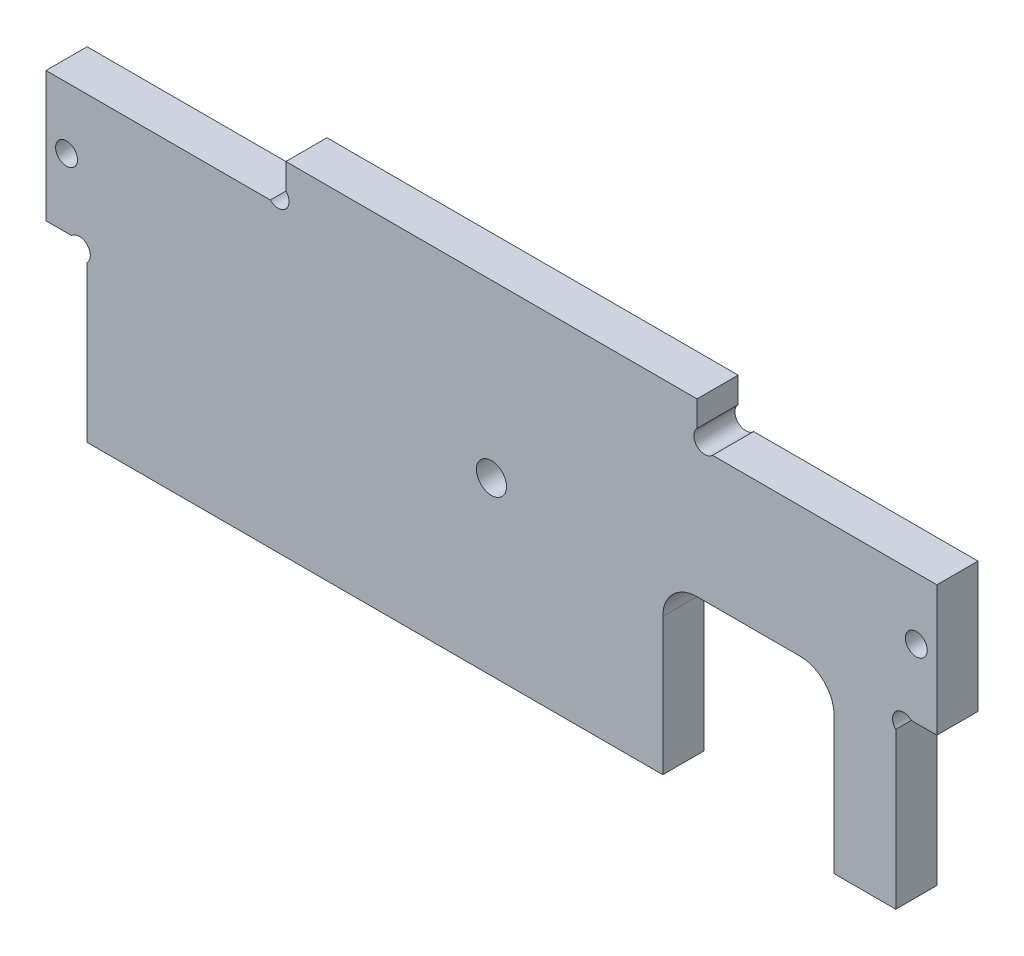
SolidWorks part; units mm, degrees
ref_plane "Plan de face" through (0, 0, 0) normal (0, 0, 1) x (1, 0, 0)
ref_plane "Plan de dessus" through (0, 0, 0) normal (0, 1, 0) x (1, 0, 0)
ref_plane "Plan de droite" through (0, 0, 0) normal (1, 0, 0) x (0, 0, -1)
sketch "Esquisse1" plane through (0, 0, 0) normal (0, 0, 1) x (1, 0, 0)
  line L0 (0, -5.3425) -> (0, 69.7724) construction
  line L1 (-53.7752, 0) -> (81.3864, 0) construction
  line L2 (-53.7752, 50) -> (81.3864, 50) construction
  line L3 (65, -11.6335) -> (65, 77.9943) construction
  line L4 (-65, -5.3425) -> (-65, 79.3023) construction
  line L5 (74.3589, 44) -> (-10.6104, 44) construction
  line L6 (30, 62.1112) -> (30, 42.1171) construction
  line L7 (59, 62.1112) -> (59, -2.7862) construction
  line L8 (77.325, 25) -> (-12.6175, 25) construction
  line L9 (62, 39.1273) -> (62, 33.0146) construction
  line L10 (74.3589, 35) -> (41.15, 35) construction
  line L11 (30, 44) -> (42.0233, 56.0233) construction
  line L12 (59, 25) -> (68.2711, 15.7289) construction
  line L13 (30, 46.2627) -> (30, 50)
  line L14 (32.2627, 44) -> (65, 44)
  line L15 (65, 44) -> (65, 25)
  line L16 (65, 25) -> (61.2627, 25)
  line L17 (59, 22.7373) -> (59, 0)
  line L18 (-59, 22.7373) -> (-59, 0)
  line L19 (-65, 25) -> (-61.2627, 25)
  line L20 (-65, 44) -> (-65, 25)
  line L21 (-32.2627, 44) -> (-65, 44)
  line L22 (-30, 46.2627) -> (-30, 50)
  line L23 (-30, 50) -> (30, 50)
  line L24 (-59, 0) -> (25, 0)
  line L25 (50, -11.6335) -> (50, 29.009) construction
  line L26 (25, -11.6335) -> (25, 29.009) construction
  line L27 (25, 0) -> (25, 20)
  line L28 (30, 25) -> (45, 25)
  line L29 (50, 20) -> (50, 0)
  line L30 (50, 0) -> (59, 0)
  circle A0 centre (62, 35) radius 1.6
  arc A1 (30, 46.2627) -> (32.2627, 44) centre (31.1314, 45.1314) ccw
  arc A2 (61.2627, 25) -> (59, 22.7373) centre (60.1314, 23.8686) ccw
  arc A3 (-61.2627, 25) -> (-59, 22.7373) centre (-60.1314, 23.8686) cw
  arc A4 (-30, 46.2627) -> (-32.2627, 44) centre (-31.1314, 45.1314) cw
  circle A5 centre (-62, 35) radius 1.6
  circle A6 centre (0, 25) radius 2.2
  arc A7 (25, 20) -> (30, 25) centre (30, 20) cw
  arc A8 (45, 25) -> (50, 20) centre (45, 20) cw
  point P63 (25, 25)
  point P66 (50, 25)
  dimension "D12" = 15
  dimension "D14" = 5
  dimension "D1" = 50
  dimension "D2" = 130
  dimension "D3" = 65
  dimension "D4" = 6
  dimension "D5" = 25
  dimension "D6" = 6
  dimension "D7" = 30
  dimension "D8" = 10
  dimension "D9" = 3
  dimension "D10" = 45
  dimension "D11" = 45
  dimension "D13" = 25
extrude "Boss.-Extru.1" add sketch "Esquisse1" along normal blind 6
